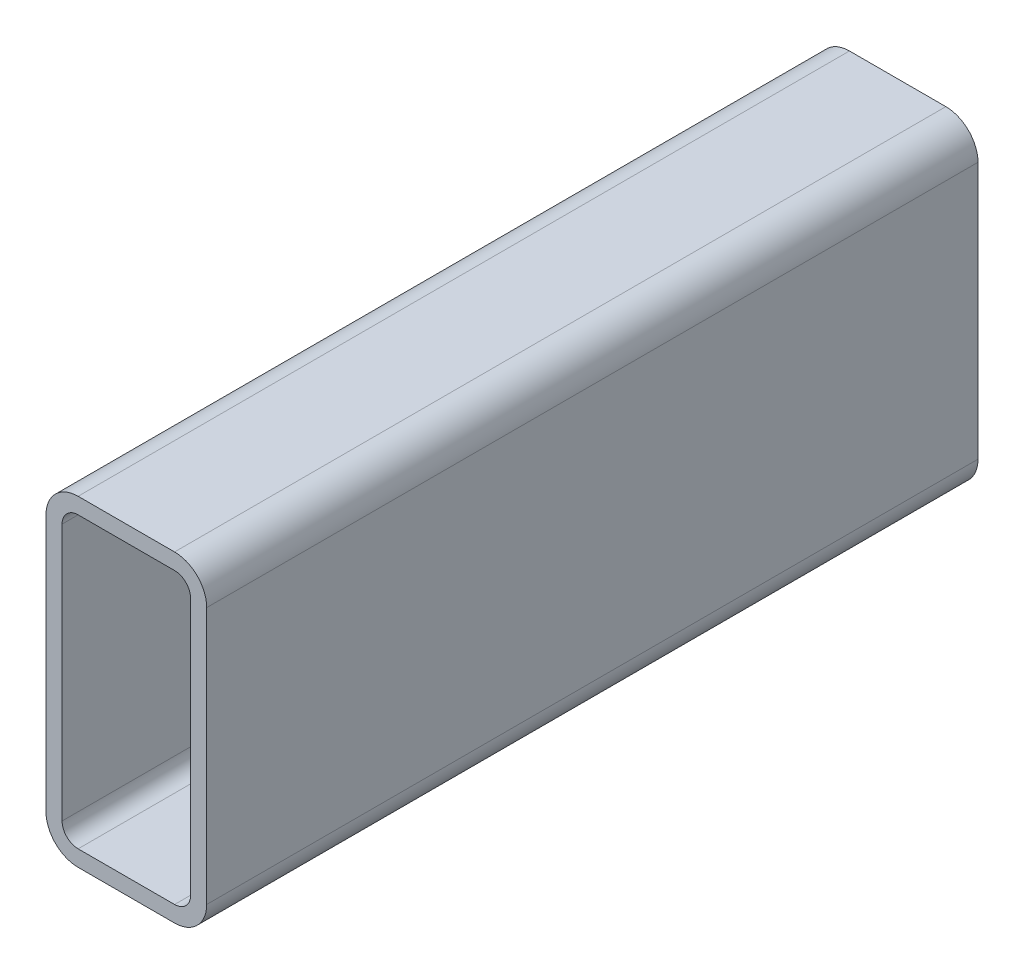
SolidWorks part; units mm, degrees
ref_plane "Front Plane" through (0, 0, 0) normal (0, 0, 1) x (1, 0, 0)
ref_plane "Top Plane" through (0, 0, 0) normal (0, 1, 0) x (1, 0, 0)
ref_plane "Right Plane" through (0, 0, 0) normal (1, 0, 0) x (0, 0, -1)
sketch "Sketch1" plane through (0, 0, 0) normal (0, 0, 1) x (1, 0, 0)
sketch_block_instance "HSS5x2.5x0.250-1"
sketch_block "HSS5x2.5x0.250"
extrude "Boss-Extrude1" add sketch "Sketch1" along normal blind 304.8
